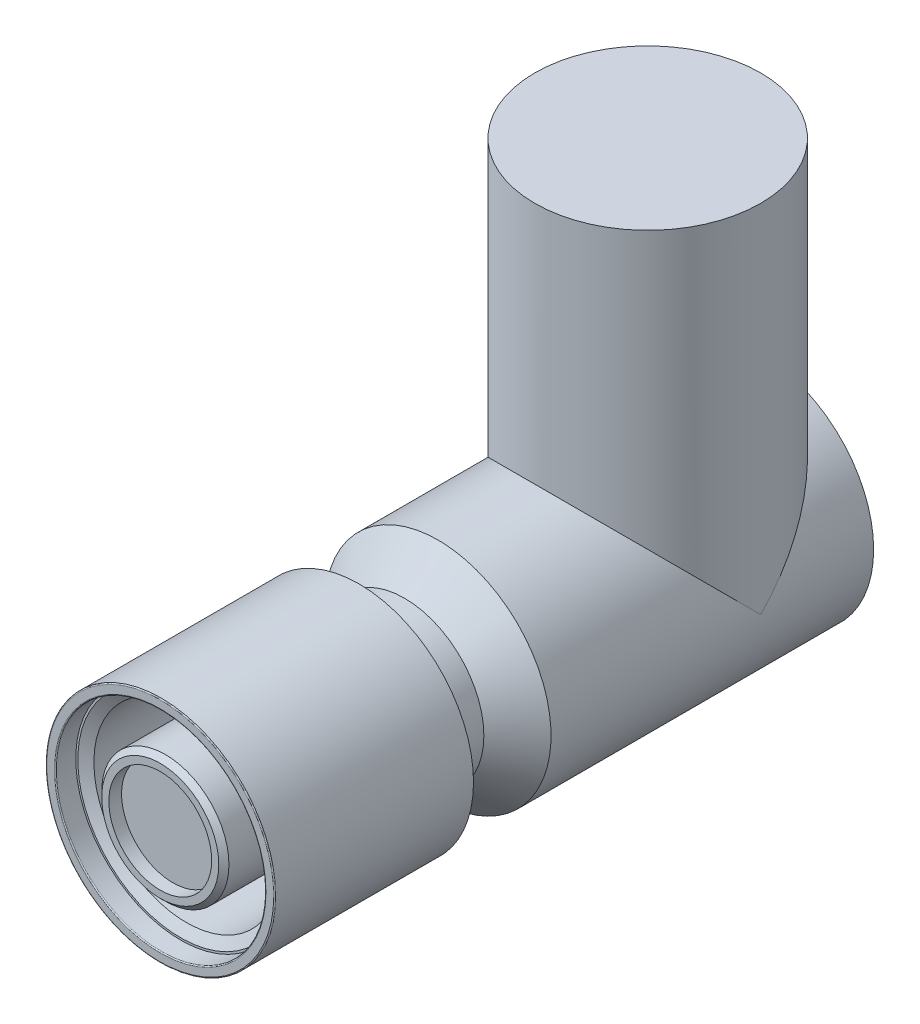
SolidWorks part; units mm, degrees
ref_plane "Front" through (0, 0, 0) normal (0, 0, 1) x (1, 0, 0)
ref_plane "Top" through (0, 0, 0) normal (0, 1, 0) x (1, 0, 0)
ref_plane "Right" through (0, 0, 0) normal (1, 0, 0) x (0, 0, -1)
sketch "Sketch1" plane through (0, 0, 0) normal (0, 0, 1) x (1, 0, 0)
  circle A0 centre (0, 0) radius 14.2875
  dimension "D1" = 28.575
extrude "Base-Extrude" add sketch "Sketch1" against normal blind 25.908
sketch "Sketch2" plane through (0, 0, 0) normal (0, 0, 1) x (1, 0, 0)
  circle A0 centre (0, 0) radius 7.9375
  circle A1 centre (0, 0) radius 11.557
  dimension "D1" = 15.875
  dimension "D2" = 23.114
extrude "Cut-Extrude1" cut sketch "Sketch2" against normal blind 18.923
sketch "Sketch3" plane through (0, 0, 0) normal (0, 0, 1) x (1, 0, 0)
  circle A0 centre (0, 0) radius 6.4135
  dimension "D1" = 12.827
extrude "Cut-Extrude2" cut sketch "Sketch3" against normal blind 1.5875
sketch "Sketch4" plane through (0, 0, 0) normal (0, 0, 1) x (1, 0, 0)
  circle A0 centre (0, 0) radius 13.081
  circle A1 centre (0, 0) radius 11.557 construction
  circle A2 centre (0, 0) radius 11.557
  dimension "D1" = 26.162
extrude "Cut-Extrude3" cut sketch "Sketch4" against normal blind 2.54
chamfer "Chamfer1" distance 0.635 angle 45 1 edges at (7.9375, 0, 0)
chamfer "Chamfer2" distance 1.27 angle 30 1 edges at (11.557, 0, -2.54)
fillet "Fillet1" radius 0.127 2 edges at (13.081, 0, 0) (14.2875, 0, 0)
chamfer "Chamfer3" distance 1.905 angle 30 1 edges at (14.2875, 0, -25.908)
sketch "Sketch5" plane through (0, 0, -25.908) normal (0, 0, -1) x (-1, 0, 0)
  circle A0 centre (0, 0) radius 9.906
  dimension "D1" = 19.812
extrude "Boss-Extrude1" add sketch "Sketch5" along normal blind 4.572
sketch "Sketch6" plane through (0, 0, -30.48) normal (0, 0, -1) x (-1, 0, 0)
  circle A0 centre (0, 0) radius 14.097
  dimension "D1" = 28.194
extrude "Boss-Extrude2" add sketch "Sketch6" along normal blind 44.45
sketch "Sketch7" plane through (0, 0, -74.93) normal (0, 0, -1) x (-1, 0, 0)
  line L0 (0, 15.4472) -> (0, -15.5813) construction
  line L1 (-17.0568, 0) -> (18.5322, 0) construction
  arc A0 (7.3861, 1.2615) -> (1.2615, 7.3861) centre (0, 0) ccw
  arc A1 (1.2615, 7.3861) -> (-1.2615, 7.3861) centre (0, 7.239) ccw
  arc A2 (7.3861, -1.2615) -> (7.3861, 1.2615) centre (7.239, 0) ccw
  arc A3 (-1.2615, -7.3861) -> (1.2615, -7.3861) centre (0, -7.239) ccw
  arc A4 (-7.3861, 1.2615) -> (-7.3861, -1.2615) centre (-7.239, 0) ccw
  arc A5 (1.2615, -7.3861) -> (7.3861, -1.2615) centre (0, 0) ccw
  arc A6 (-7.3861, -1.2615) -> (-1.2615, -7.3861) centre (0, 0) ccw
  arc A7 (-1.2615, 7.3861) -> (-7.3861, 1.2615) centre (0, 0) ccw
  dimension "D1" = 14.986
  dimension "D2" = 2.54
  dimension "D3" = 17.018
extrude "Boss-Extrude3" [suppressed] add sketch "Sketch7" along normal blind 17.526
fillet "Fillet2" [suppressed] radius 6.604
chamfer "Chamfer4" distance 4.191 angle 45 1 edges at (-14.097, 0, -30.48)
sketch "Sketch9" [suppressed] plane through (0, 0, 0) normal (0, 1, 0) x (1, 0, 0)
  line L0 (5.0438, 108.077) -> (4.699, 108.077)
  line L1 (7.3861, 108.077) -> (1.2615, 108.077) construction
  line L2 (8.509, 104.267) -> (8.509, 102.7706)
  line L3 (8.509, 90.551) -> (8.509, 108.077) construction
  line L4 (8.509, 102.7706) -> (12.916, 102.7706)
  line L5 (12.916, 102.7706) -> (12.916, 110.5949)
  line L6 (12.916, 110.5949) -> (5.0438, 110.5949)
  line L7 (5.0438, 110.5949) -> (5.0438, 108.077)
  line L8 (0, 101.981) -> (0, 112.3655) construction
  line L9 (0, 18.923) -> (0, 3.2732) construction
  arc A0 (4.699, 108.077) -> (8.509, 104.267) centre (4.699, 104.267) cw
  dimension "D1" = 3.81
revolve "Cut-Revolve2" [suppressed] cut sketch "Sketch9" angle 360 about L8
sketch "Sketch10" plane through (0, 0, 0) normal (0, 1, 0) x (1, 0, 0)
  line L0 (14.097, 74.93) -> (-14.097, 74.93) construction
  circle A0 centre (0, 60.833) radius 14.097
extrude "Extrude1" add sketch "Sketch10" along normal blind 44.45
